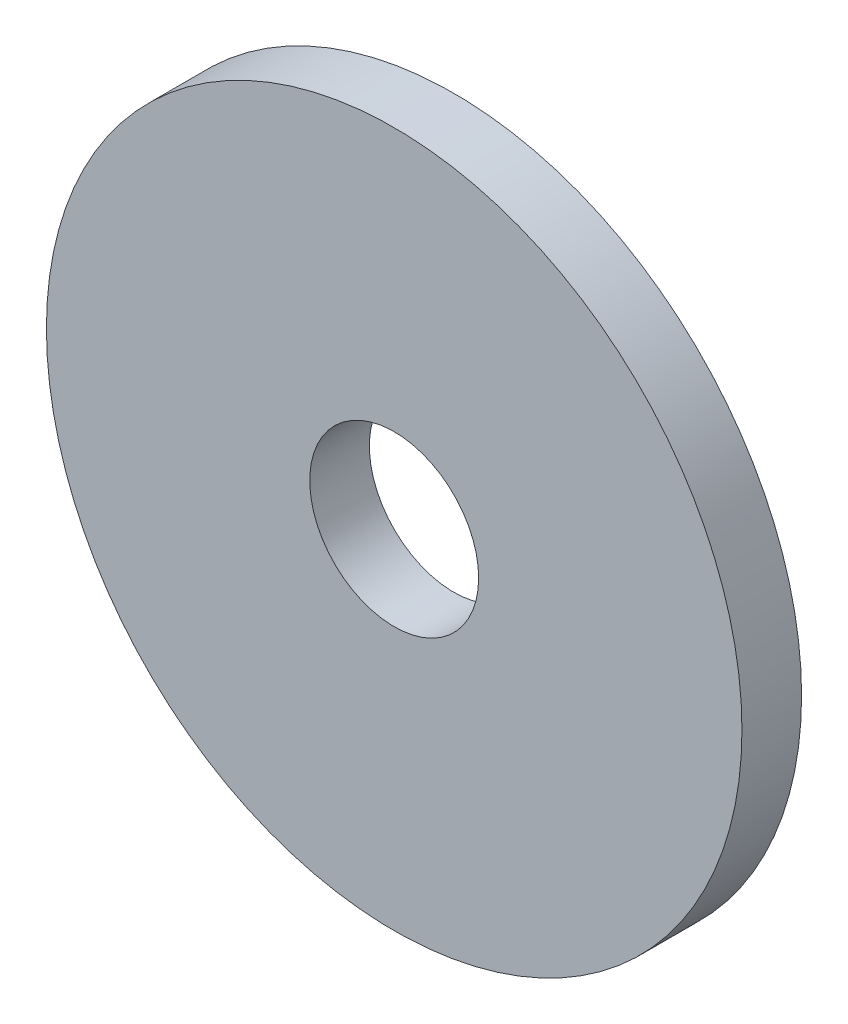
SolidWorks part; units mm, degrees
ref_plane "Face" through (0, 0, 0) normal (0, 0, 1) x (1, 0, 0)
ref_plane "Dessus" through (0, 0, 0) normal (0, 1, 0) x (1, 0, 0)
ref_plane "Droite" through (0, 0, 0) normal (1, 0, 0) x (0, 0, -1)
sketch "Esquisse1" plane through (0, 0, 0) normal (0, 0, 1) x (1, 0, 0)
  circle A0 centre (0, 0) radius 35
  circle A1 centre (0, 0) radius 8.5
  dimension "D1" = 70
  dimension "D2" = 17
extrude "Base-Extrusion" add sketch "Esquisse1" along normal blind 6
